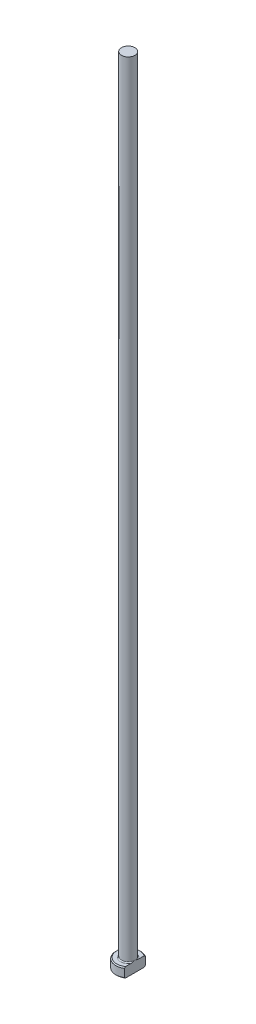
SolidWorks part; units mm, degrees
ref_plane "Front Plane" through (0, 0, 0) normal (0, 0, 1) x (1, 0, 0)
ref_plane "Top Plane" through (0, 0, 0) normal (0, 1, 0) x (1, 0, 0)
ref_plane "Right Plane" through (0, 0, 0) normal (1, 0, 0) x (0, 0, -1)
sketch "Sketch1" plane through (0, 0, 0) normal (0, 0, 1) x (1, 0, 0)
  line L0 (0, 259.9588) -> (0, -15.1925) construction
  line L1 (0, 0) -> (-2.5, 0)
  line L2 (-2.5, 0) -> (-2.5, 2)
  line L3 (-2.5, 2) -> (-1.35, 2)
  line L4 (-1.35, 2) -> (-1.35, 160)
  line L5 (-1.35, 160) -> (0, 160)
  line L6 (0, 160) -> (0, 0)
  dimension "L" = 160
  dimension "H" = 5
  dimension "T" = 2
  dimension "D" = 2.7
revolve "Revolve1" add sketch "Sketch1" angle 360 about L0
chamfer "Chamfer1" distance 0.2 angle 45 2 edges at (0, 2, 2.5) (0, 0, 2.5)
fillet "Fillet1" radius 0.2 1 edges at (0, 2, 1.35)
sketch "Sketch2" plane through (0, 0, 0) normal (0, 1, 0) x (1, 0, 0)
  line L0 (1.35, 2.1042) -> (1.35, -2.1042)
  circle A0 centre (0, 0) radius 2.5 construction
  arc A1 (1.35, -2.1042) -> (1.35, 2.1042) centre (0, 0) ccw
  circle A2 centre (0, 0) radius 1.35 construction
extrude "KEY" cut sketch "Sketch2" along normal through all
